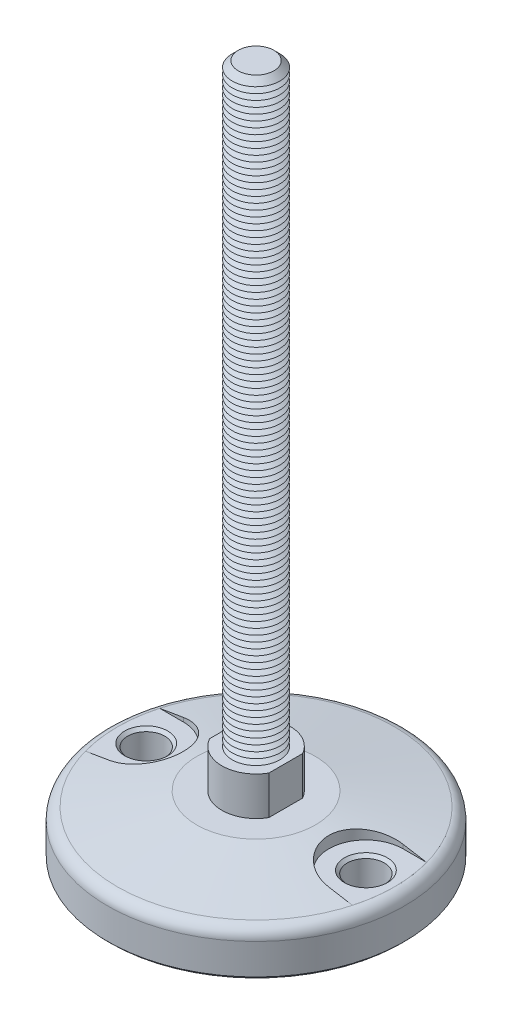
SolidWorks part; units mm, degrees
ref_plane "Front Plane" through (0, 0, 0) normal (0, 0, 1) x (1, 0, 0)
ref_plane "Top Plane" through (0, 0, 0) normal (0, 1, 0) x (1, 0, 0)
ref_plane "Right Plane" through (0, 0, 0) normal (1, 0, 0) x (0, 0, -1)
sketch "Sketch1" plane through (0, 0, 0) normal (1, 0, 0) x (0, 0, -1)
  line L0 (0, 61.3389) -> (0, -58.404) construction
sketch "Sketch2" plane through (0, 0, 0) normal (1, 0, 0) x (0, 0, -1)
  line L0 (0, 0) -> (-20, 0)
  line L1 (-20, 0) -> (-50, -5.2898)
  line L2 (-50, -5.2898) -> (-50, -20)
  line L3 (-50, -20) -> (0, -20)
  line L4 (0, 61.3389) -> (0, -58.404) construction
  line L5 (0, -20) -> (0, 0)
  dimension "D1" = 20
  dimension "D2" = 50
  dimension "D3" = 20
  dimension "D4" = 10
revolve "Revolve1" add sketch "Sketch2" angle 360 about L0
fillet "Fillet1" radius 4 1 edges at (0, -5.2898, 50)
sketch "Sketch3" plane through (0, 0, 0) normal (0, 1, 0) x (1, 0, 0)
  circle A0 centre (0, 0) radius 11.5
  dimension "D1" = 23
extrude "Boss-Extrude1" add sketch "Sketch3" along normal blind 13
sketch "Sketch4" plane through (0, 13, 0) normal (0, 1, 0) x (1, 0, 0)
  line L0 (-10, 5.6789) -> (-10, -5.6789)
  line L2 (10, -5.6789) -> (10, 5.6789)
  arc A0 (-10, 5.6789) -> (-10, -5.6789) centre (0, 0) ccw
  circle A1 centre (0, 0) radius 11.5 construction
  arc A2 (10, -5.6789) -> (10, 5.6789) centre (0, 0) ccw
  dimension "D1" = 20
extrude "Cut-Extrude1" cut sketch "Sketch4" against normal blind 13
sketch "Sketch5" plane through (0, 13, 0) normal (0, 1, 0) x (1, 0, 0)
  circle A0 centre (0, 0) radius 8
  dimension "D1" = 16
extrude "Boss-Extrude2" add sketch "Sketch5" along normal blind 200
chamfer "Chamfer1" distance 2 angle 45 1 edges at (0, 213, 8)
sketch "Sketch6" plane through (0, 0, 0) normal (1, 0, 0) x (0, 0, -1)
  line L0 (-8, 13) -> (-6.2679, 14)
  line L1 (-6.2679, 14) -> (-8, 15)
  line L2 (-8, 211) -> (-8, 13) construction
  line L3 (-8, 15) -> (-8, 13)
  dimension "D1" = 2
revolve "Cut-Revolve1" cut sketch "Sketch6" angle 360 about L0
pattern_linear "LPattern1" count 99 spacing 2 along (0, 1, 0) of "Cut-Revolve1"
sketch "Sketch8" plane through (0, 0, 0) normal (0, 1, 0) x (1, 0, 0)
  line L0 (-37, 12.5) -> (-44.9904, 12.5)
  line L1 (-37, -12.5) -> (-44.9904, -12.5)
  arc A1 (-44.9904, 12.5) -> (-44.9904, -12.5) centre (0, 0) ccw
  circle A2 centre (0, 0) radius 46.6946 construction
  arc A3 (-37, -12.5) -> (-37, 12.5) centre (-37, 0) ccw
  point P3 (-37, 0)
  point P11 (0, 0)
  dimension "D1" = 37
  dimension "D2" = 25
extrude "Cut-Extrude4" cut sketch "Sketch8" against normal blind 4.7
sketch "Sketch10" plane through (0, -4.7, 0) normal (0, 1, 0) x (1, 0, 0)
  circle A0 centre (-37, 0) radius 6.25
  dimension "D1" = 12.5
extrude "Cut-Extrude5" cut sketch "Sketch10" against normal up to surface (15.3 mm away)
chamfer "Chamfer2" distance 1 angle 45 2 edges at (-37, -20, -6.25) (-37, -4.7, 6.25)
mirror "Mirror1" about plane through (0, 0, 0) normal (1, 0, 0) of "Chamfer2", "Cut-Extrude5", "Cut-Extrude4"
chamfer "Chamfer3" distance 1 angle 45 1 edges at (0, -20, 50)
